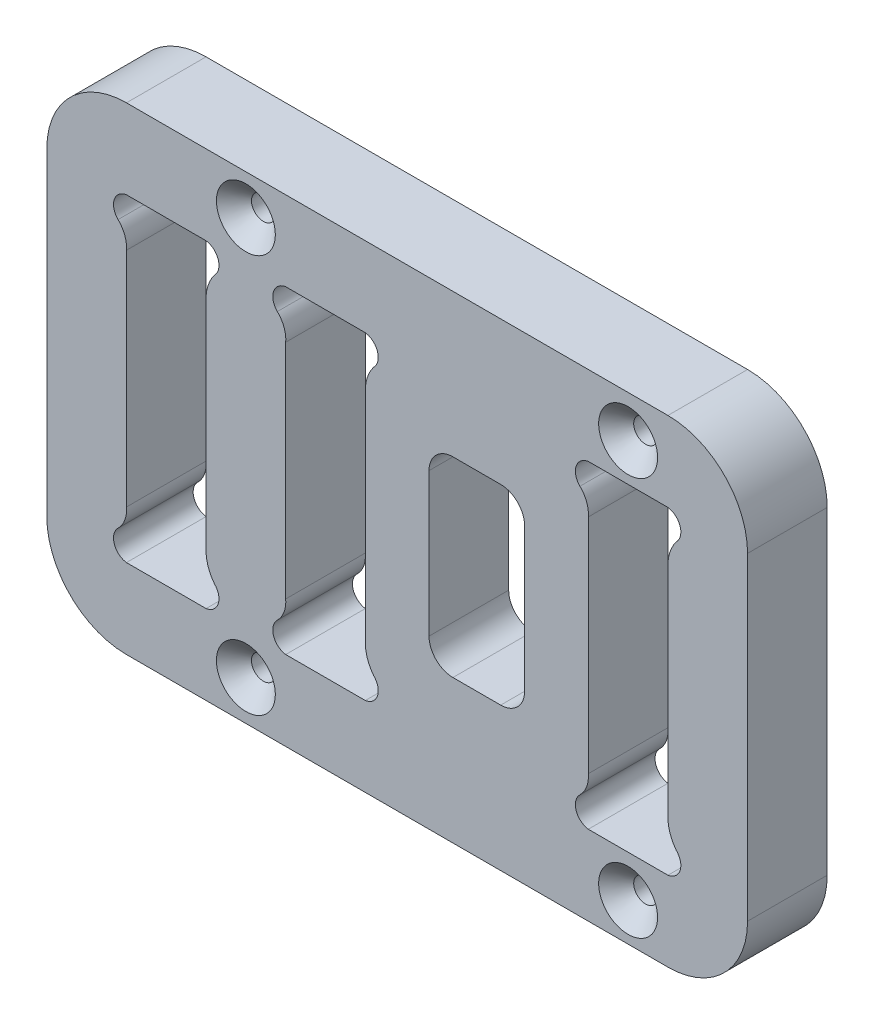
SolidWorks part; units mm, degrees
ref_plane "Plan de face" through (0, 0, 0) normal (0, 0, 1) x (1, 0, 0)
ref_plane "Plan de dessus" through (0, 0, 0) normal (0, 1, 0) x (1, 0, 0)
ref_plane "Plan de droite" through (0, 0, 0) normal (1, 0, 0) x (0, 0, -1)
sketch "Esquisse1" plane through (0, 0, 0) normal (0, 0, 1) x (1, 0, 0)
  line L5 (-87.4883, 20.4298) -> (-87.4883, 60.4298)
  line L7 (-175.4883, 60.4298) -> (-175.4883, 20.4298)
  line L12 (-145.4883, 60.4298) -> (-135.4883, 60.4298)
  line L14 (-165.4883, 70.4298) -> (-97.4883, 70.4298)
  line L15 (-145.4883, 20.4298) -> (-135.4883, 20.4298)
  line L16 (-165.4883, 60.4298) -> (-155.4883, 60.4298)
  line L17 (-165.4883, 10.4298) -> (-97.4883, 10.4298)
  line L18 (-196.9153, 40.4298) -> (-137.9698, 40.4298) construction
  line L20 (-165.4883, 20.4298) -> (-155.4883, 20.4298)
  line L21 (-165.4883, 54.3899) -> (-165.4883, 26.4696)
  line L22 (-155.4883, 54.3899) -> (-155.4883, 26.4696)
  line L23 (-160.4883, 79.7483) -> (-160.4883, 7.3285) construction
  line L24 (-145.4883, 54.3899) -> (-145.4883, 26.4696)
  line L25 (-135.4883, 54.3899) -> (-135.4883, 26.4696)
  line L26 (-140.4883, 79.7483) -> (-140.4883, 7.3285) construction
  line L27 (-107.4883, 60.4298) -> (-97.4883, 60.4298)
  line L28 (-107.4883, 20.4298) -> (-97.4883, 20.4298)
  line L29 (-107.4883, 54.3899) -> (-107.4883, 26.4696)
  line L30 (-97.4883, 54.3899) -> (-97.4883, 26.4696)
  line L31 (-102.4883, 79.7483) -> (-102.4883, 7.3285) construction
  arc A28 (-175.4883, 60.4298) -> (-165.4883, 70.4298) centre (-165.4883, 60.4298) cw
  arc A29 (-87.4883, 60.4298) -> (-97.4883, 70.4298) centre (-97.4883, 60.4298) ccw
  arc A41 (-175.4883, 20.4298) -> (-165.4883, 10.4298) centre (-165.4883, 20.4298) ccw
  arc A42 (-87.4883, 20.4298) -> (-97.4883, 10.4298) centre (-97.4883, 20.4298) cw
  arc A43 (-165.4883, 54.3899) -> (-166.537, 57.2066) centre (-168.976, 54.6949) ccw
  arc A44 (-165.4883, 60.4298) -> (-166.537, 57.2066) centre (-165.2219, 58.5609) ccw
  arc A45 (-155.4883, 54.3899) -> (-154.4395, 57.2066) centre (-150.3946, 54.0969) cw
  arc A46 (-155.4883, 60.4298) -> (-154.4395, 57.2066) centre (-155.7546, 58.5609) cw
  arc A47 (-155.4883, 20.4298) -> (-154.4395, 23.6529) centre (-155.7546, 22.2986) ccw
  arc A48 (-155.4883, 26.4696) -> (-154.4395, 23.6529) centre (-150.3946, 26.7626) ccw
  arc A49 (-165.4883, 20.4298) -> (-166.537, 23.6529) centre (-165.2219, 22.2986) cw
  arc A50 (-165.4883, 26.4696) -> (-166.537, 23.6529) centre (-168.976, 26.1646) cw
  circle A51 centre (-150.4883, 65.4298) radius 1.5
  circle A52 centre (-150.4883, 15.4298) radius 1.5
  arc A53 (-145.4883, 54.3899) -> (-146.537, 57.2066) centre (-148.976, 54.6949) ccw
  arc A54 (-145.4883, 60.4298) -> (-146.537, 57.2066) centre (-145.2219, 58.5609) ccw
  arc A55 (-135.4883, 54.3899) -> (-134.4395, 57.2066) centre (-130.3946, 54.0969) cw
  arc A56 (-135.4883, 60.4298) -> (-134.4395, 57.2066) centre (-135.7546, 58.5609) cw
  arc A57 (-135.4883, 20.4298) -> (-134.4395, 23.6529) centre (-135.7546, 22.2986) ccw
  arc A58 (-135.4883, 26.4696) -> (-134.4395, 23.6529) centre (-130.3946, 26.7626) ccw
  arc A59 (-145.4883, 20.4298) -> (-146.537, 23.6529) centre (-145.2219, 22.2986) cw
  arc A60 (-145.4883, 26.4696) -> (-146.537, 23.6529) centre (-148.976, 26.1646) cw
  arc A63 (-107.4883, 54.3899) -> (-108.537, 57.2066) centre (-110.976, 54.6949) ccw
  arc A64 (-107.4883, 60.4298) -> (-108.537, 57.2066) centre (-107.2219, 58.5609) ccw
  arc A65 (-97.4883, 54.3899) -> (-96.4395, 57.2066) centre (-92.3946, 54.0969) cw
  arc A66 (-97.4883, 60.4298) -> (-96.4395, 57.2066) centre (-97.7546, 58.5609) cw
  arc A67 (-97.4883, 20.4298) -> (-96.4395, 23.6529) centre (-97.7546, 22.2986) ccw
  arc A68 (-97.4883, 26.4696) -> (-96.4395, 23.6529) centre (-92.3946, 26.7626) ccw
  arc A69 (-107.4883, 20.4298) -> (-108.537, 23.6529) centre (-107.2219, 22.2986) cw
  arc A70 (-107.4883, 26.4696) -> (-108.537, 23.6529) centre (-110.976, 26.1646) cw
  circle A71 centre (-102.4883, 65.191) radius 1.5
  circle A72 centre (-102.4883, 15.191) radius 1.5
  circle A73 centre (-130.4883, 65.4298) radius 1.5
  circle A74 centre (-130.4883, 15.4298) radius 1.5
  point P58 (-160.4883, 60.4298)
  dimension "D7" = 60
  dimension "D8" = 10
  dimension "D9" = 10
  dimension "D10" = 10
  dimension "D11" = 30
  dimension "D13" = 10
  dimension "D3" = 3
  dimension "D2" = 20
  dimension "D4" = 2
  dimension "D5" = 88
  dimension "D6" = 2
  dimension "D12" = 10
  dimension "D14" = 25
  dimension "D15" = 10
extrude "Boss.-Extru.1" add sketch "Esquisse1" along normal blind 10
chamfer "Chanfrein1" distance 2.2 angle 45 4 edges at (-151.9883, 15.4298, 10) (-103.9883, 15.191, 10) (-100.9883, 65.191, 10) (-148.9883, 65.4298, 10)
sketch "Esquisse2" plane through (0, 0, 0) normal (0, 0, -1) x (-1, 0, 0)
  line L0 (107.4883, 54.3899) -> (107.4883, 26.4696) construction
  line L1 (118.4883, 52.4298) -> (124.4883, 52.4298)
  line L2 (115.4883, 49.4298) -> (115.4883, 31.4298)
  line L3 (118.4883, 28.4298) -> (124.4883, 28.4298)
  line L4 (127.4883, 49.4298) -> (127.4883, 31.4298)
  line L5 (135.4883, 26.4696) -> (135.4883, 54.3899) construction
  line L6 (97.4883, 60.4298) -> (107.4883, 60.4298) construction
  line L7 (107.4883, 20.4298) -> (97.4883, 20.4298) construction
  arc A0 (115.4883, 31.4298) -> (118.4883, 28.4298) centre (118.4883, 31.4298) ccw
  arc A1 (124.4883, 28.4298) -> (127.4883, 31.4298) centre (124.4883, 31.4298) ccw
  arc A2 (124.4883, 52.4298) -> (127.4883, 49.4298) centre (124.4883, 49.4298) cw
  arc A3 (118.4883, 52.4298) -> (115.4883, 49.4298) centre (118.4883, 49.4298) ccw
  dimension "D3" = 3
  dimension "D1" = 8
  dimension "D2" = 8
  dimension "D4" = 8
  dimension "D5" = 8
extrude "Enlèv. mat.-Extru.1" cut sketch "Esquisse2" against normal through all
